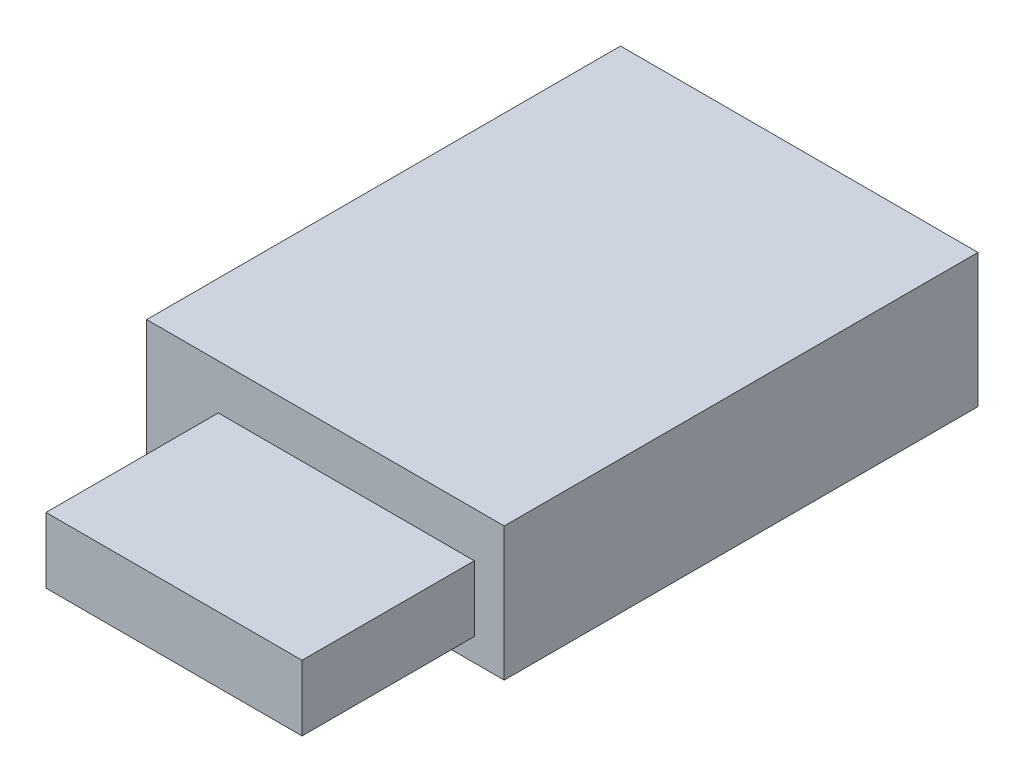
SolidWorks part; units mm, degrees
ref_plane "Front Plane" through (0, 0, 0) normal (0, 0, 1) x (1, 0, 0)
ref_plane "Top Plane" through (0, 0, 0) normal (0, 1, 0) x (1, 0, 0)
ref_plane "Right Plane" through (0, 0, 0) normal (1, 0, 0) x (0, 0, -1)
sketch "Sketch1" plane through (0, 0, 0) normal (0, 1, 0) x (1, 0, 0)
  line L1 (-39.4278, 91.3298) -> (65.9822, 91.3298)
  line L2 (-39.4278, 91.3298) -> (-39.4278, -48.3702)
  line L3 (-39.4278, -48.3702) -> (65.9822, -48.3702)
  line L4 (65.9822, 91.3298) -> (65.9822, -48.3702)
  dimension "D1" = 105.41
  dimension "D2" = 139.7
extrude "Extrude1" add sketch "Sketch1" along normal blind 39.37
sketch "Sketch2" plane through (0, 0, 48.3702) normal (0, 0, 1) x (1, 0, 0)
  line L1 (-18.3243, 26.0741) -> (57.1672, 26.0741)
  line L2 (-18.3243, 26.0741) -> (-18.3243, 6.7371)
  line L3 (-18.3243, 6.7371) -> (57.1672, 6.7371)
  line L4 (57.1672, 26.0741) -> (57.1672, 6.7371)
extrude "Extrude2" add sketch "Sketch2" along normal blind 50.8
